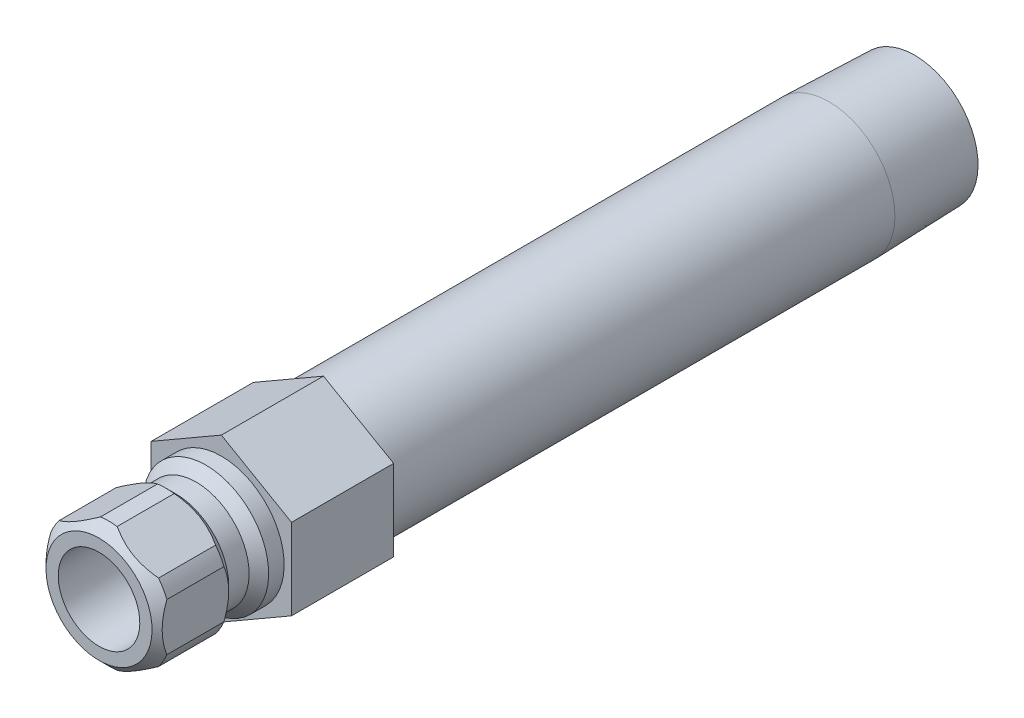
SolidWorks part; units mm, degrees
ref_plane "Front Plane" through (0, 0, 0) normal (0, 0, 1) x (1, 0, 0)
ref_plane "Top Plane" through (0, 0, 0) normal (0, 1, 0) x (1, 0, 0)
ref_plane "Right Plane" through (0, 0, 0) normal (1, 0, 0) x (0, 0, -1)
sketch "Sketch1" plane through (0, 0, 0) normal (1, 0, 0) x (0, 0, -1)
  line L0 (0, 0) -> (-12.7, 0) construction
  line L1 (-9.525, 3.175) -> (-9.525, 4.1275)
  line L2 (-3.556, 4.1275) -> (-3.556, 0) construction
  line L3 (-8.763, 4.8895) -> (-4.318, 4.8895)
  line L4 (0, 5.1435) -> (0, 3.4163) construction
  line L5 (-3.556, 4.1275) -> (-1.9685, 4.1275)
  line L6 (-1.2065, 4.8895) -> (0, 4.8895)
  line L7 (0, 4.8895) -> (0, 5.1435)
  line L8 (-3.556, 4.1275) -> (-4.318, 4.8895)
  line L9 (-1.9685, 4.1275) -> (-1.2065, 4.8895)
  line L10 (-9.525, 4.1275) -> (-8.763, 4.8895)
  line L12 (0, 5.1435) -> (47.2948, 5.1435)
  line L13 (47.2948, 5.1435) -> (53.975, 4.9347)
  line L14 (53.975, 4.9347) -> (53.975, 2.3813)
  line L15 (0, 0) -> (7.9502, 0) construction
  line L16 (7.9502, 0) -> (7.9502, 4.8895) construction
  line L17 (7.9502, 4.8895) -> (0, 4.8895) construction
  line L18 (0.127, 2.3813) -> (53.975, 2.3813)
  line L19 (0.127, 3.175) -> (-9.525, 3.175)
  line L20 (0, 3.175) -> (0, 0) construction
  line L21 (0.127, 2.3813) -> (0.127, 3.175)
  dimension "D1" = 9.525
  dimension "D2" = 1.5875
  dimension "D3" = 0.762
  dimension "D4" = 45
  dimension "D5" = 5.969
  dimension "D6" = 45
  dimension "D7" = 1.79
  dimension "D8" = 6.6802
  dimension "D9" = 63.5
  dimension "D10" = 3.175
  dimension "D11" = 17.4752
  dimension "D12" = 4.7625
  dimension "D13" = 6.35
  dimension "D14" = 9.779
  dimension "D15" = 10.287
  dimension "D16" = 9.652
revolve "Revolve1" add sketch "Sketch1" angle 360 about L0
sketch "Sketch2" plane through (0, 0, 0) normal (0, 0, 1) x (1, 0, 0)
  line L1 (-5.461, 3.1529) -> (-5.461, -3.1529)
  line L2 (-5.461, -3.1529) -> (0, -6.3058)
  line L3 (0, -6.3058) -> (5.461, -3.1529)
  line L4 (5.461, -3.1529) -> (5.461, 3.1529)
  line L5 (5.461, 3.1529) -> (0, 6.3058)
  line L6 (0, 6.3058) -> (-5.461, 3.1529)
  circle A0 centre (0, 0) radius 5.461 construction
  circle A1 centre (0, 0) radius 2.3812 construction
  circle A2 centre (0, 0) radius 2.3812
  dimension "D1" = 10.922
extrude "Boss-Extrude1" add sketch "Sketch2" against normal up to vertex (7.9502 mm away) from vertex at 0
sketch "Sketch3" plane through (0, 0, 0) normal (0, 0, 1) x (1, 0, 0)
  line L1 (-4.5212, -2.6103) -> (0, -5.2206)
  line L2 (0, -5.2206) -> (4.5212, -2.6103)
  line L3 (4.5212, -2.6103) -> (4.5212, 2.6103)
  line L4 (4.5212, 2.6103) -> (0, 5.2206)
  line L5 (0, 5.2206) -> (-4.5212, 2.6103)
  line L6 (-4.5212, 2.6103) -> (-4.5212, -2.6103)
  circle A0 centre (0, 0) radius 4.5212 construction
  dimension "D1" = 9.0424
extrude "Cut-Extrude1" cut sketch "Sketch3" along normal through all from vertex at 3.556 flip side to cut
